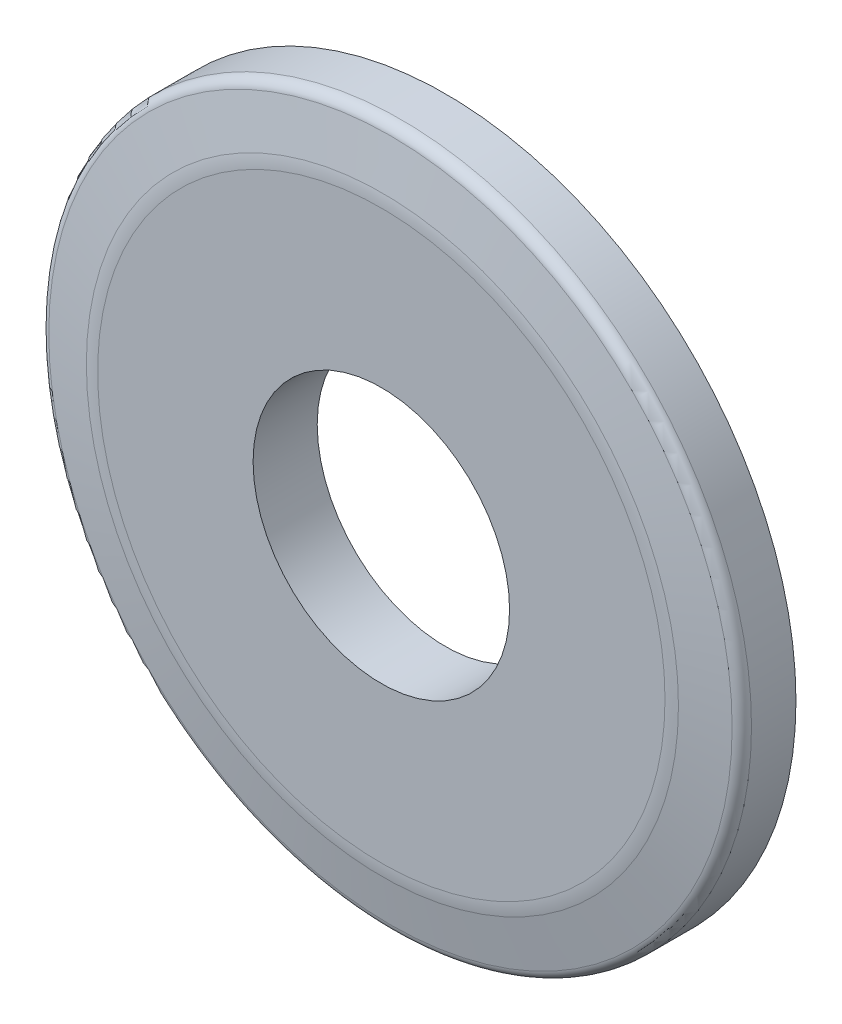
SolidWorks part; units mm, degrees
ref_plane "Front" through (0, 0, 0) normal (0, 0, 1) x (1, 0, 0)
ref_plane "Top" through (0, 0, 0) normal (0, 1, 0) x (1, 0, 0)
ref_plane "Right" through (0, 0, 0) normal (1, 0, 0) x (0, 0, -1)
sketch "Sketch1" plane through (0, 0, 0) normal (0, 0, 1) x (1, 0, 0)
  circle A0 centre (0, 0) radius 24.9936
  circle A1 centre (0, 0) radius 9.144
  dimension "D1" = 18.288
  dimension "D2" = 49.9872
extrude "Extrude1" add sketch "Sketch1" along normal blind 4.572
chamfer "Chamfer1" distance 0.762 angle 80 1 edges at (24.9936, 0, 4.572)
fillet "Fillet1" radius 0.762 1 edges at (24.9936, 0, 3.81)
fillet "Fillet2" radius 5.08 1 edges at (20.6721, 0, 4.572)
